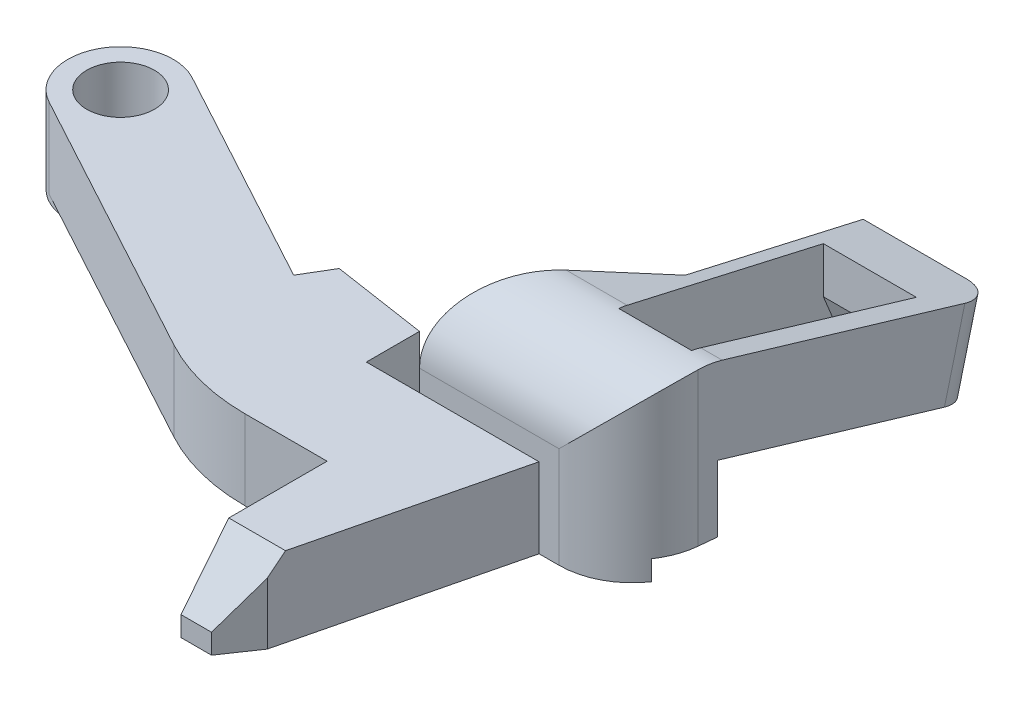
SolidWorks part; units mm, degrees
ref_plane "Front Plane" through (0, 0, 0) normal (0, 0, 1) x (1, 0, 0)
ref_plane "Top Plane" through (0, 0, 0) normal (0, 1, 0) x (1, 0, 0)
ref_plane "Right Plane" through (0, 0, 0) normal (1, 0, 0) x (0, 0, -1)
sketch "Sketch1" plane through (0, 0, 0) normal (0, 1, 0) x (1, 0, 0)
  line L0 (2.4037, 4.432) -> (30.48, -10.795)
  line L1 (-2.4037, -4.432) -> (27.9216, -20.8788)
  line L2 (-2.4037, -4.432) -> (2.4037, 4.432) construction
  line L3 (30.48, -10.795) -> (50.8, -10.795)
  line L4 (27.9216, -20.8788) -> (40.6216, -20.8788)
  line L5 (40.6216, -20.8788) -> (40.6216, -31.6738)
  line L6 (45.7016, -31.6738) -> (50.8, -10.795)
  line L7 (40.6216, -31.6738) -> (40.6216, -34.8488)
  line L8 (40.6216, -34.8488) -> (43.5426, -34.8488)
  line L9 (43.5426, -34.8488) -> (45.7016, -31.6738)
  circle A0 centre (0, 0) radius 3.2385
  arc A1 (2.4037, 4.432) -> (-2.4037, -4.432) centre (0, 0) ccw
  dimension "D1" = 6.477
  dimension "D2" = 10.0838
  dimension "D3" = 30.48
  dimension "D4" = 10.0838
  dimension "D5" = 10.795
  dimension "D6" = 20.32
  dimension "D7" = 12.7
  dimension "D8" = 10.795
  dimension "D9" = 5.08
  dimension "D10" = 3.175
  dimension "D11" = 2.921
extrude "Boss-Extrude1" add sketch "Sketch1" along normal blind 7.62
sketch "Sketch2" plane through (0, 0, 0) normal (0, -1, 0) x (1, 0, 0)
  circle A0 centre (0, 0) radius 5.0419
  circle A1 centre (0, 0) radius 3.2385
extrude "Boss-Extrude2" add sketch "Sketch2" along normal blind 0.635
sketch "Sketch3" plane through (0, 7.62, 0) normal (0, 1, 0) x (1, 0, 0)
  line L0 (34.29, -10.795) -> (34.29, -5.715)
  line L1 (50.8, -10.795) -> (30.48, -10.795) construction
  line L2 (23.622, -7.0756) -> (25.2486, -4.3489)
  line L3 (30.48, -10.795) -> (2.4037, 4.432) construction
  line L4 (25.2486, -4.3489) -> (34.29, -5.715)
  line L5 (30.48, -10.795) -> (23.622, -7.0756)
  line L6 (30.48, -10.795) -> (34.29, -10.795)
  dimension "D1" = 3.81
  dimension "D2" = 5.08
  dimension "D3" = 10.668
  dimension "D4" = 3.175
  dimension "D5" = 9.144
extrude "Boss-Extrude3" add sketch "Sketch3" against normal blind 10.16 contours L2 L4 L0 L6 L5
ref_plane "Plane1" through (39.37, 0, 0) normal (1, 0, 0) x (0, 0, -1)
sketch "Sketch4" plane through (39.37, 0, 0) normal (-1, 0, 0) x (0, 0, 1)
  line L0 (10.795, 7.62) -> (10.795, 0) construction
  line L1 (10.795, 7.62) -> (10.795, 0)
  line L2 (10.795, 0) -> (7.747, 0)
  line L3 (7.747, 0) -> (7.747, 1.905)
  line L4 (7.747, 1.905) -> (2.794, 1.905)
  line L5 (2.794, 1.905) -> (2.794, 8.255)
  line L6 (2.794, 8.255) -> (-19.685, 3.1316)
  line L7 (-19.685, 3.1316) -> (-21.463, 10.9325)
  line L8 (-21.463, 10.9325) -> (2.3781, 16.3664)
  line L9 (10.795, 9.652) -> (10.795, 7.62)
  arc A0 (2.3781, 16.3664) -> (10.795, 9.652) centre (3.9084, 9.652) cw
  dimension "D1" = 1.905
  dimension "D2" = 3.048
  dimension "D3" = 8.001
  dimension "D4" = 30.48
  dimension "D5" = 8.001
  dimension "D6" = 32.258
  dimension "D7" = 2.032
  dimension "D8" = 6.35
extrude "Boss-Extrude4" add sketch "Sketch4" against normal blind 22.86 contours L8 A0 L9 L1 L2 L3 L4 L5 L6 L7
ref_plane "Plane2" through (0, 16.5386, 0) normal (0, 1, 0) x (1, 0, 0)
sketch "Sketch8" plane through (0, 16.5386, 0) normal (0, 1, 0) x (1, 0, 0)
  line L0 (39.37, -2.3781) -> (39.37, -10.795) construction
  line L1 (39.37, 21.463) -> (39.37, -2.3781) construction
  line L2 (39.37, -10.795) -> (34.29, -10.795) construction
  line L3 (34.29, -10.795) -> (34.29, -5.715) construction
  line L4 (39.37, -2.3781) -> (39.37, -10.795)
  line L5 (39.37, 21.463) -> (39.37, -2.3781)
  line L6 (39.37, -10.795) -> (34.29, -10.795)
  line L7 (34.29, -10.795) -> (34.29, -5.715)
  line L8 (49.53, 21.463) -> (49.53, 4.445)
  line L9 (62.23, 21.463) -> (39.37, 21.463) construction
  line L10 (49.53, 4.445) -> (39.37, -10.795)
  line L11 (36.83, -10.795) -> (36.83, 21.463)
  line L12 (36.83, 21.463) -> (49.53, 21.463)
  dimension "D1" = 10.16
  dimension "D2" = 17.018
extrude "Cut-Extrude2" cut sketch "Sketch8" against normal through all contours L12 L11 L6 L4 L5 | L12 L5 L4 L10 L8
sketch "Sketch9" plane through (0, 16.5386, 0) normal (0, 1, 0) x (1, 0, 0)
  line L0 (58.5836, -15.5849) -> (62.23, 21.463)
  line L1 (62.23, 21.463) -> (71.1621, 21.463)
  line L2 (71.1621, 21.463) -> (71.1621, -15.5849)
  line L3 (71.1621, -15.5849) -> (58.5836, -15.5849)
  line L4 (62.23, 21.463) -> (62.23, -2.3781) construction
  line L5 (62.23, 21.463) -> (49.53, 21.463) construction
  line L6 (62.23, -10.795) -> (62.23, -2.3781) construction
  line L7 (62.23, -10.795) -> (39.37, -10.795) construction
  line L8 (62.23, 21.463) -> (62.23, -2.3781)
  line L9 (62.23, 21.463) -> (49.53, 21.463)
  line L10 (62.23, -10.795) -> (62.23, -2.3781)
  line L11 (62.23, -10.795) -> (39.37, -10.795)
  line L12 (45.7016, -31.6738) -> (50.8, -10.795) construction
  line L13 (45.7016, -31.6738) -> (50.8, -10.795)
  point P2 (59.055, -10.795)
  dimension "D1" = 19.685
extrude "Cut-Extrude3" cut sketch "Sketch9" against normal through all contours L1 L2 L3 L0
sketch "Sketch10" plane through (0, 16.5386, 0) normal (0, 1, 0) x (1, 0, 0)
  line L0 (50.8, 16.383) -> (59.6882, 16.383)
  line L1 (59.6882, 16.383) -> (57.7632, -3.175)
  line L2 (57.7632, -3.175) -> (50.8, -3.175)
  line L3 (50.8, -3.175) -> (50.8, 16.383)
  line L4 (49.53, 4.445) -> (49.53, 21.463) construction
  line L5 (62.23, 21.463) -> (49.53, 21.463) construction
  line L6 (59.055, -10.795) -> (39.37, -10.795) construction
  line L7 (62.23, 21.463) -> (59.8834, -2.3781) construction
  dimension "D1" = 1.27
  dimension "D2" = 5.08
  dimension "D3" = 7.62
  dimension "D4" = 2.032
extrude "Cut-Extrude4" cut sketch "Sketch10" against normal through all
sketch "Sketch11" plane through (39.37, 0, 0) normal (1, 0, 0) x (0, 0, -1)
  line L0 (-30.2768, 7.62) -> (-34.8488, 1.905)
  line L1 (-34.8488, 7.62) -> (-34.8488, 0) construction
  line L2 (-34.8488, 1.905) -> (-34.8488, 7.62)
  line L3 (-34.8488, 7.62) -> (-30.2768, 7.62)
  dimension "D1" = 5.715
  dimension "D2" = 4.572
extrude "Cut-Extrude5" cut sketch "Sketch11" against normal through all both and the other way through all
fillet "Fillet1" radius 19.05 1 edges at (27.9216, 3.81, 20.8788)
fillet "Fillet2" radius 2.54 1 edges at (62.1425, 7.032, -20.574)
sketch "Sketch12" plane through (0, 16.5386, 0) normal (0, 1, 0) x (1, 0, 0)
  line L0 (59.055, -10.795) -> (39.37, -10.795) construction
  line L1 (59.055, -10.795) -> (59.8834, -2.3781) construction
  line L2 (52.705, -10.795) -> (52.705, -15.3532)
  line L3 (52.705, -15.3532) -> (62.0778, -15.3532)
  line L4 (62.0778, -15.3532) -> (62.0778, -4.4755)
  line L5 (62.0778, -4.4755) -> (59.677, -4.4755)
  line L6 (59.677, -4.4755) -> (59.6378, -4.4954)
  arc A0 (52.705, -10.795) -> (59.677, -4.4755) centre (52.705, -3.7893) ccw
  dimension "D1" = 1.905
extrude "Cut-Extrude8" cut sketch "Sketch12" against normal through all contours A0 L2 L3 L4 L5
chamfer "Chamfer2" distance 3.81 distance2 1.778 1 edges at (55.2441, 3.8842, -16.383)
